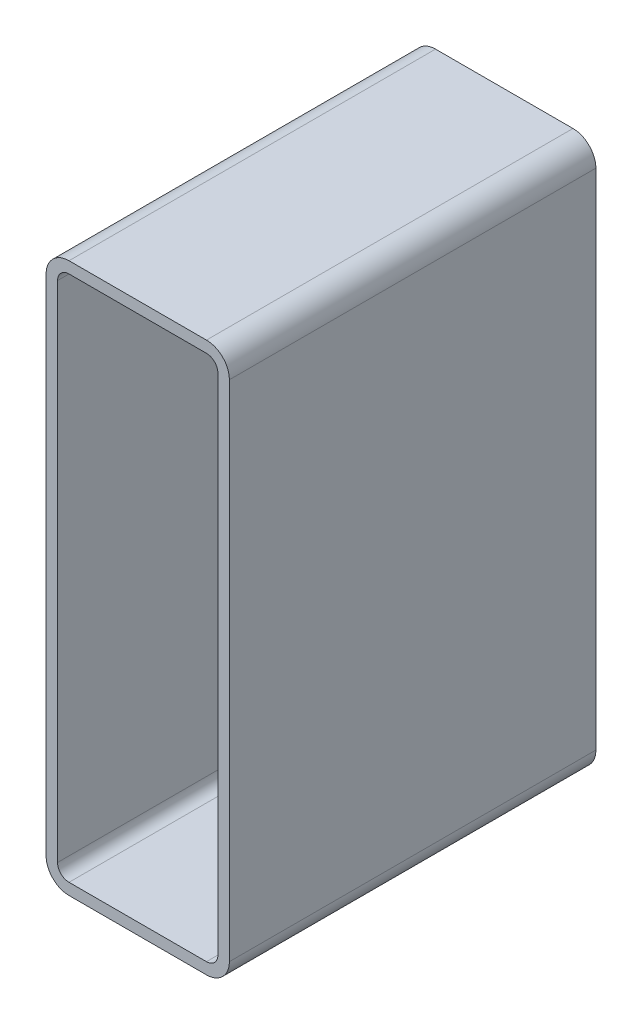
SolidWorks part; units mm, degrees
ref_plane "Front Plane" through (0, 0, 0) normal (0, 0, 1) x (1, 0, 0)
ref_plane "Top Plane" through (0, 0, 0) normal (0, 1, 0) x (1, 0, 0)
ref_plane "Right Plane" through (0, 0, 0) normal (1, 0, 0) x (0, 0, -1)
sketch "Sketch1" plane through (0, 0, 0) normal (0, 0, 1) x (1, 0, 0)
sketch_block_instance "HSS18x6x0.375-1"
sketch_block "HSS18x6x0.375"
extrude "Boss-Extrude1" add sketch "Sketch1" along normal blind 304.8
